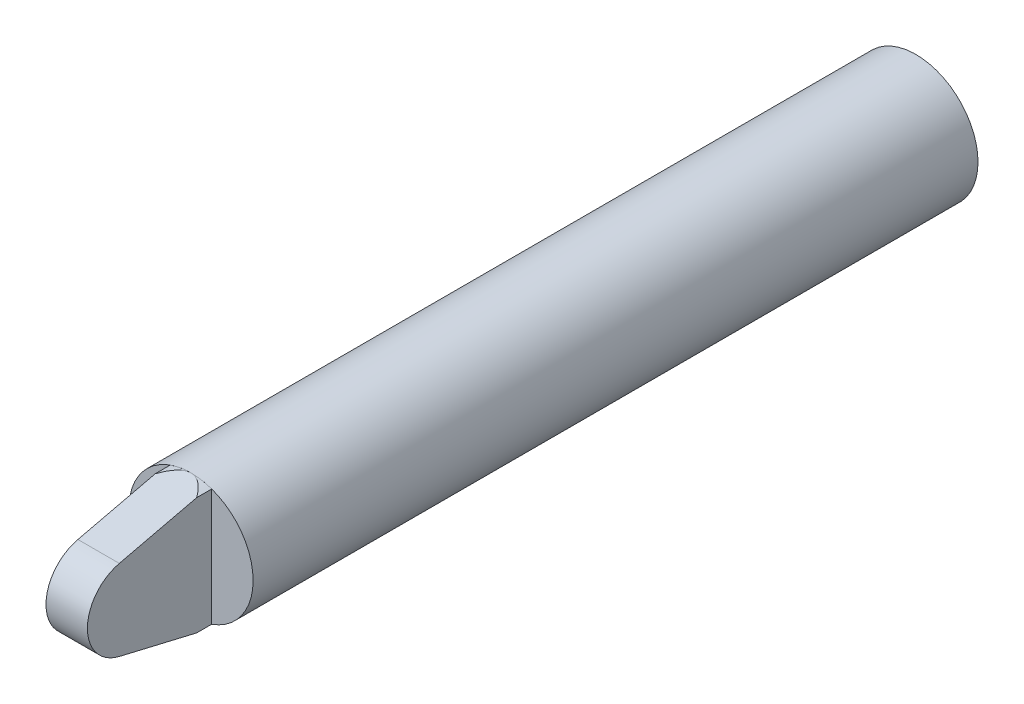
SolidWorks part; units mm, degrees
ref_plane "Ebene vorne" through (0, 0, 0) normal (0, 0, 1) x (1, 0, 0)
ref_plane "Ebene oben" through (0, 0, 0) normal (0, 1, 0) x (1, 0, 0)
ref_plane "Ebene rechts" through (0, 0, 0) normal (1, 0, 0) x (0, 0, -1)
sketch "Skizze1" plane through (0, 0, 0) normal (0, 0, 1) x (1, 0, 0)
  circle A0 centre (0, 0) radius 30
  dimension "D1" = 60
extrude "Linear austragen1" add sketch "Skizze1" along normal blind 350
sketch "Skizze2" plane through (0, 0, 0) normal (1, 0, 0) x (0, 0, -1)
  line L0 (-350, 30) -> (-350, -30) construction
  line L1 (-350, 30) -> (-394.5982, 19.4642)
  line L2 (-350, 0) -> (-390, 0) construction
  line L3 (-350, -30) -> (-394.5982, -19.4642)
  line L4 (-350, 30) -> (-350, -30)
  arc A0 (-394.5982, 19.4642) -> (-394.5982, -19.4642) centre (-390, 0) ccw
  dimension "D1" = 40
  dimension "D2" = 40
extrude "Linear austragen2" add sketch "Skizze2" along normal mid plane 20 separate body
sketch "Skizze3" plane through (0, 0, 0) normal (0, 0, -1) x (-1, 0, 0)
  circle A0 centre (0, 0) radius 30 construction
  circle A1 centre (0, 0) radius 30
extrude "Schnitt-Linear austragen1" cut sketch "Skizze3" against normal through all flip side to cut
